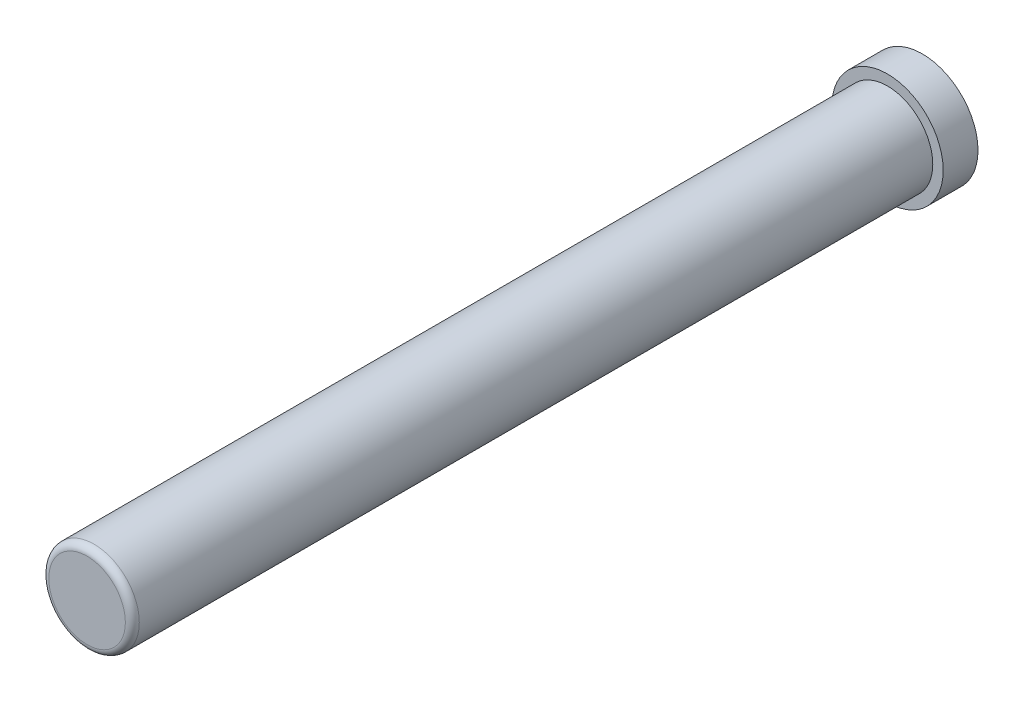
SolidWorks part; units mm, degrees
ref_plane "前视基准面" through (0, 0, 0) normal (0, 0, 1) x (1, 0, 0)
ref_plane "上视基准面" through (0, 0, 0) normal (0, 1, 0) x (1, 0, 0)
ref_plane "右视基准面" through (0, 0, 0) normal (1, 0, 0) x (0, 0, -1)
sketch "草图1" plane through (0, 0, 0) normal (0, 0, 1) x (1, 0, 0)
  circle A0 centre (0, 0) radius 8
extrude "凸台-拉伸1" add sketch "草图1" along normal blind 5
sketch "草图2" plane through (0, 0, 5) normal (0, 0, 1) x (1, 0, 0)
  circle A0 centre (0, 0) radius 6.5
extrude "凸台-拉伸2" add sketch "草图2" along normal blind 115
fillet "圆角1" radius 1 1 edges at (6.5, 0, 120)
